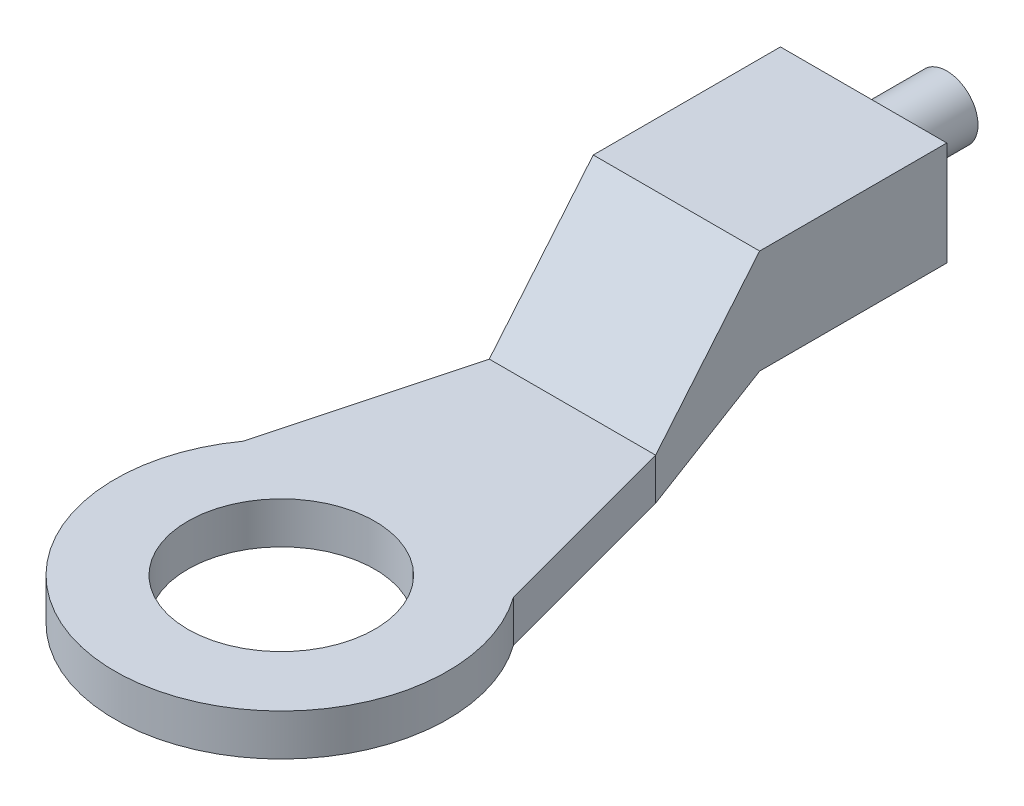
SolidWorks part; units mm, degrees
ref_plane "Vorne" through (0, 0, 0) normal (0, 0, 1) x (1, 0, 0)
ref_plane "Oben" through (0, 0, 0) normal (0, 1, 0) x (1, 0, 0)
ref_plane "Rechts" through (0, 0, 0) normal (1, 0, 0) x (0, 0, -1)
sketch "Skizze1" plane through (0, 0, 0) normal (0, 1, 0) x (1, 0, 0)
  line L0 (-3.25, 2.3318) -> (-2, 7)
  line L1 (-2, 7) -> (2, 7)
  line L2 (2, 7) -> (3.25, 2.3318)
  line L3 (0, 0) -> (0, 7) construction
  circle A0 centre (0, 0) radius 2.25
  arc A1 (-3.25, 2.3318) -> (3.25, 2.3318) centre (0, 0) ccw
  dimension "D1" = 4.5
  dimension "D2" = 4
  dimension "D3" = 11
  dimension "D4" = 4
  dimension "D5" = 6.5
extrude "Linear austragen1" add sketch "Skizze1" along normal blind 1
sketch "Skizze2" plane through (0, 0, 0) normal (1, 0, 0) x (0, 0, -1)
  line L0 (7, 1) -> (9.5, 4)
  line L1 (9.5, 4) -> (14, 4)
  line L2 (14, 4) -> (14, 1.5)
  line L3 (14, 1.5) -> (9.5, 1.5)
  line L4 (9.5, 1.5) -> (7, 0)
  line L5 (7, 1) -> (7, 0) construction
  line L6 (7, 1) -> (7, 0)
  line L7 (2.3318, 0) -> (7, 0) construction
  dimension "D1" = 7
  dimension "D2" = 4.5
  dimension "D3" = 1.5
  dimension "D4" = 2.5
extrude "Linear austragen2" add sketch "Skizze2" along normal up to vertex (2 mm away) and the other way up to vertex (2 mm away)
sketch "Skizze3" plane through (0, 0, -14) normal (0, 0, -1) x (-1, 0, 0)
  line L0 (0, 1.5) -> (0, 4) construction
  line L1 (-2, 1.5) -> (2, 1.5) construction
  line L2 (-2, 4) -> (2, 4) construction
  line L3 (-2, 2.75) -> (2, 2.75) construction
  line L4 (-2, 1.5) -> (-2, 4) construction
  line L5 (2, 1.5) -> (2, 4) construction
  circle A0 centre (0, 2.75) radius 0.75
  dimension "D1" = 1.5
extrude "Linear austragen3" add sketch "Skizze3" along normal blind 2
